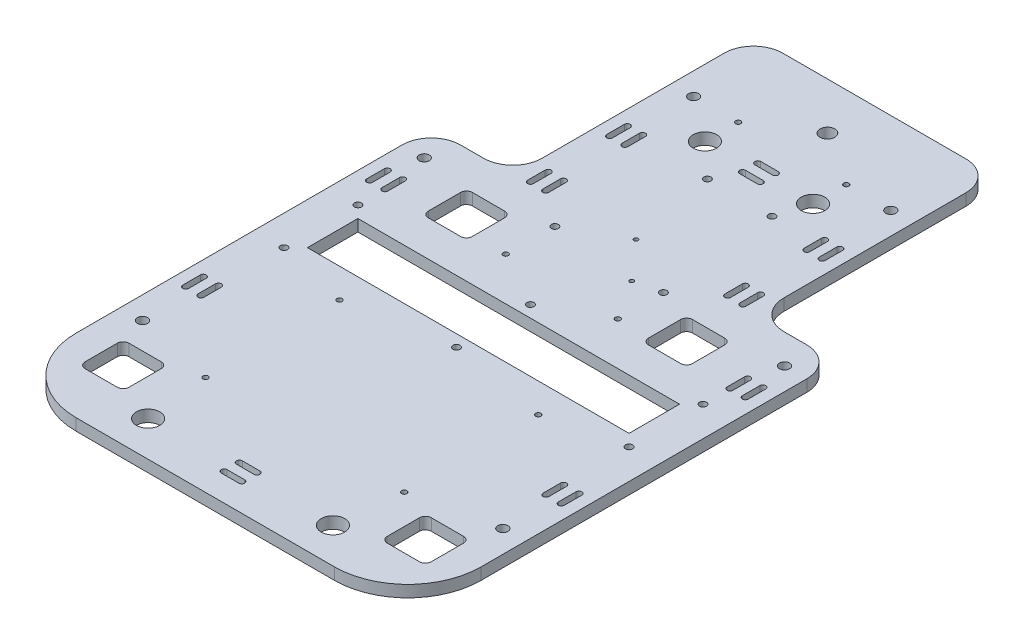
SolidWorks part; units mm, degrees
ref_plane "Front Plane" through (0, 0, 0) normal (0, 0, 1) x (1, 0, 0)
ref_plane "Top Plane" through (0, 0, 0) normal (0, 1, 0) x (1, 0, 0)
ref_plane "Right Plane" through (0, 0, 0) normal (1, 0, 0) x (0, 0, -1)
sketch "Sketch1" plane through (0, 0, 0) normal (0, 1, 0) x (1, 0, 0)
  line L0 (0, 0) -> (0, 289.56)
  line L1 (0, 289.56) -> (-52.324, 289.56)
  line L2 (-52.324, 289.56) -> (-52.324, 185.42)
  line L3 (-52.324, 185.42) -> (-87.63, 185.42)
  line L4 (-87.63, 185.42) -> (-87.63, 0)
  line L5 (-87.63, 0) -> (0, 0)
  dimension "D1" = 289.56
  dimension "D2" = 87.63
  dimension "D3" = 104.14
  dimension "D4" = 52.324
extrude "Plate" add sketch "Sketch1" along normal blind 5.08
fillet "Fillet1" radius 12.7 2 edges at (-52.324, 2.54, -185.42) (-87.63, 2.54, -185.42)
fillet "Fillet2" radius 12.7 1 edges at (-52.324, 2.54, -289.56)
fillet "Fillet3" radius 31.75 1 edges at (-87.63, 2.54, 0)
sketch "Sketch2" plane through (0, 5.08, 0) normal (0, 1, 0) x (1, 0, 0)
  line L0 (0, 0) -> (0, 289.56) construction
  line L1 (-69.596, 135.636) -> (0, 135.636)
  line L2 (-69.596, 135.636) -> (-69.596, 113.792)
  line L3 (-69.596, 113.792) -> (0, 113.792)
  line L4 (0, 135.636) -> (0, 113.792)
  line L5 (-55.88, 0) -> (0, 0) construction
  dimension "D1" = 21.844
  dimension "D2" = 69.596
  dimension "D3" = 113.792
extrude "BatterySlot" cut sketch "Sketch2" against normal through all
sketch "Sketch6" plane through (0, 5.08, 0) normal (0, 1, 0) x (1, 0, 0)
  line L0 (-55.88, 0) -> (0, 0) construction
  line L1 (-57.15, 170.18) -> (-38.1, 170.18)
  line L2 (-57.15, 170.18) -> (-57.15, 151.13)
  line L3 (-57.15, 151.13) -> (-38.1, 151.13)
  line L4 (-38.1, 170.18) -> (-38.1, 151.13)
  line L5 (-74.93, 39.37) -> (-55.88, 39.37)
  line L6 (-74.93, 39.37) -> (-74.93, 20.32)
  line L7 (-74.93, 20.32) -> (-55.88, 20.32)
  line L8 (-55.88, 39.37) -> (-55.88, 20.32)
  line L9 (-87.63, 172.72) -> (-87.63, 31.75) construction
  line L10 (-65.024, 185.42) -> (-74.93, 185.42) construction
  dimension "D1" = 19.05
  dimension "D2" = 20.32
  dimension "D3" = 12.7
  dimension "D4" = 30.48
  dimension "D5" = 15.24
extrude "CableHoles" cut sketch "Sketch6" against normal through all
fillet "CabelHoleFillets" radius 2.54 8 edges at (-57.15, 2.54, -151.13) (-57.15, 2.54, -170.18) (-38.1, 2.54, -170.18) (-38.1, 2.54, -151.13) (-55.88, 2.54, -20.32) (-55.88, 2.54, -39.37) (-74.93, 2.54, -39.37) (-74.93, 2.54, -20.32)
sketch "Sketch7" plane through (0, 5.08, 0) normal (0, 1, 0) x (1, 0, 0)
  line L0 (-55.88, 0) -> (0, 0) construction
  line L2 (0, 0) -> (0, 113.792) construction
  line L5 (0, 289.56) -> (-39.624, 289.56) construction
  line L6 (0, 135.636) -> (0, 289.56) construction
  circle A0 centre (-23.401, 239.6236) radius 5.08
  circle A1 centre (-39.9999, 15.24) radius 5.08
  dimension "D1" = 10.16
  dimension "D2" = 15.24
  dimension "D3" = 224.3836
  dimension "D4" = 39.9999
  dimension "D5" = 23.401
  dimension "D6" = 49.9364
extrude "AnchorHoles" cut sketch "Sketch7" against normal through all
sketch "Sketch8" plane through (0, 5.08, 0) normal (0, 1, 0) x (1, 0, 0)
  line L0 (-45.974, 228.6) -> (-45.974, 220.98) construction
  line L1 (-44.704, 228.6) -> (-44.704, 220.98)
  line L2 (-47.244, 228.6) -> (-47.244, 220.98)
  line L3 (-39.37, 228.6) -> (-39.37, 220.98) construction
  line L4 (-38.1, 228.6) -> (-38.1, 220.98)
  line L5 (-40.64, 228.6) -> (-40.64, 220.98)
  line L6 (-45.974, 194.31) -> (-45.974, 186.69) construction
  line L7 (-44.704, 194.31) -> (-44.704, 186.69)
  line L8 (-47.244, 194.31) -> (-47.244, 186.69)
  line L9 (-39.37, 194.31) -> (-39.37, 186.69) construction
  line L10 (-38.1, 194.31) -> (-38.1, 186.69)
  line L11 (-40.64, 194.31) -> (-40.64, 186.69)
  line L12 (-81.28, 160.02) -> (-81.28, 152.4) construction
  line L13 (-80.01, 160.02) -> (-80.01, 152.4)
  line L14 (-82.55, 160.02) -> (-82.55, 152.4)
  line L15 (-74.676, 160.02) -> (-74.676, 152.4) construction
  line L16 (-73.406, 160.02) -> (-73.406, 152.4)
  line L17 (-75.946, 160.02) -> (-75.946, 152.4)
  line L18 (-81.28, 80.391) -> (-81.28, 72.771) construction
  line L19 (-80.01, 80.391) -> (-80.01, 72.771)
  line L20 (-82.55, 80.391) -> (-82.55, 72.771)
  line L21 (-74.676, 80.391) -> (-74.676, 72.771) construction
  line L22 (-73.406, 80.391) -> (-73.406, 72.771)
  line L23 (-75.946, 80.391) -> (-75.946, 72.771)
  line L24 (-69.596, 113.792) -> (-69.596, 39.37) construction
  line L27 (-58.42, 39.37) -> (-72.39, 39.37) construction
  line L30 (-52.324, 276.86) -> (-52.324, 198.12) construction
  line L31 (-87.63, 172.72) -> (-87.63, 31.75) construction
  line L32 (-3.81, 236.3216) -> (3.81, 236.3216) construction
  line L33 (-3.81, 237.5916) -> (3.81, 237.5916)
  line L34 (-3.81, 235.0516) -> (3.81, 235.0516)
  line L35 (-3.81, 242.9256) -> (3.81, 242.9256) construction
  line L36 (-3.81, 244.1956) -> (3.81, 244.1956)
  line L37 (-3.81, 241.6556) -> (3.81, 241.6556)
  line L38 (-3.81, 11.938) -> (3.81, 11.938) construction
  line L39 (-3.81, 13.208) -> (3.81, 13.208)
  line L40 (-3.81, 10.668) -> (3.81, 10.668)
  line L41 (-3.81, 18.542) -> (3.81, 18.542) construction
  line L42 (-3.81, 19.812) -> (3.81, 19.812)
  line L43 (-3.81, 17.272) -> (3.81, 17.272)
  line L45 (0, 0) -> (0, 113.792) construction
  line L46 (-54.61, 151.13) -> (-40.64, 151.13) construction
  line L47 (-74.93, 36.83) -> (-74.93, 22.86) construction
  line L48 (-55.88, 0) -> (0, 0) construction
  line L49 (-69.977, 185.42) -> (0, 185.42) construction
  line L50 (-65.024, 185.42) -> (-74.93, 185.42) construction
  line L51 (0, 135.636) -> (0, 289.56) construction
  arc A0 (-44.704, 228.6) -> (-47.244, 228.6) centre (-45.974, 228.6) ccw
  arc A1 (-47.244, 220.98) -> (-44.704, 220.98) centre (-45.974, 220.98) ccw
  arc A2 (-38.1, 228.6) -> (-40.64, 228.6) centre (-39.37, 228.6) ccw
  arc A3 (-40.64, 220.98) -> (-38.1, 220.98) centre (-39.37, 220.98) ccw
  arc A4 (-44.704, 194.31) -> (-47.244, 194.31) centre (-45.974, 194.31) ccw
  arc A5 (-47.244, 186.69) -> (-44.704, 186.69) centre (-45.974, 186.69) ccw
  arc A6 (-38.1, 194.31) -> (-40.64, 194.31) centre (-39.37, 194.31) ccw
  arc A7 (-40.64, 186.69) -> (-38.1, 186.69) centre (-39.37, 186.69) ccw
  arc A8 (-80.01, 160.02) -> (-82.55, 160.02) centre (-81.28, 160.02) ccw
  arc A9 (-82.55, 152.4) -> (-80.01, 152.4) centre (-81.28, 152.4) ccw
  arc A10 (-73.406, 160.02) -> (-75.946, 160.02) centre (-74.676, 160.02) ccw
  arc A11 (-75.946, 152.4) -> (-73.406, 152.4) centre (-74.676, 152.4) ccw
  arc A12 (-80.01, 80.391) -> (-82.55, 80.391) centre (-81.28, 80.391) ccw
  arc A13 (-82.55, 72.771) -> (-80.01, 72.771) centre (-81.28, 72.771) ccw
  arc A14 (-73.406, 80.391) -> (-75.946, 80.391) centre (-74.676, 80.391) ccw
  arc A15 (-75.946, 72.771) -> (-73.406, 72.771) centre (-74.676, 72.771) ccw
  arc A20 (-3.81, 237.5916) -> (-3.81, 235.0516) centre (-3.81, 236.3216) ccw
  arc A21 (3.81, 235.0516) -> (3.81, 237.5916) centre (3.81, 236.3216) ccw
  arc A22 (-3.81, 244.1956) -> (-3.81, 241.6556) centre (-3.81, 242.9256) ccw
  arc A23 (3.81, 241.6556) -> (3.81, 244.1956) centre (3.81, 242.9256) ccw
  arc A24 (-3.81, 13.208) -> (-3.81, 10.668) centre (-3.81, 11.938) ccw
  arc A25 (3.81, 10.668) -> (3.81, 13.208) centre (3.81, 11.938) ccw
  arc A26 (-3.81, 19.812) -> (-3.81, 17.272) centre (-3.81, 18.542) ccw
  arc A27 (3.81, 17.272) -> (3.81, 19.812) centre (3.81, 18.542) ccw
  circle A29 centre (-39.9999, 15.24) radius 5.08 construction
  circle A30 centre (-23.401, 239.6236) radius 5.08 construction
  point P2 (-45.974, 224.79)
  point P7 (-39.37, 224.79)
  point P14 (-45.974, 219.71)
  point P15 (-45.974, 229.87)
  point P18 (-45.974, 190.5)
  point P23 (-39.37, 190.5)
  point P34 (-81.28, 156.21)
  point P39 (-74.676, 156.21)
  point P50 (-81.28, 76.581)
  point P55 (-74.676, 76.581)
  point P68 (-69.596, 76.581)
  point P73 (-73.406, 76.581)
  point P77 (-74.676, 161.29)
  point P78 (0, 236.3216)
  point P83 (0, 242.9256)
  point P90 (0, 11.938)
  point P97 (0, 18.542)
  point P107 (-81.28, 71.501)
  point P113 (-45.974, 185.42)
  point P117 (-47.625, 151.13)
  point P118 (-74.676, 151.13)
  point P122 (-45.974, 195.58)
  dimension "D8" = 2.032
  dimension "D1" = 10.16
  dimension "D2" = 2.54
  dimension "D3" = 4.064
  dimension "D4" = 5.08
  dimension "D5" = 5.08
  dimension "D6" = 4.064
  dimension "D7" = 2.032
  dimension "D9" = 4.064
  dimension "D10" = 2.032
  dimension "D11" = 2.032
  dimension "D12" = 4.064
  dimension "D13" = 24.13
  dimension "D15" = 24.13
  dimension "D16" = 71.501
  dimension "D17" = 0
extrude "ZipTieHoles" cut sketch "Sketch8" against normal through all
sketch "Sketch3" plane through (0, 5.08, 0) normal (0, 1, 0) x (1, 0, 0)
  line L0 (-23.401, 234.5436) -> (-23.401, 289.56) construction
  line L1 (0, 0) -> (0, 10.668) construction
  line L2 (-69.596, 113.792) -> (0, 113.792) construction
  line L3 (0, 244.1956) -> (0, 289.56) construction
  line L4 (0, 289.56) -> (-39.624, 289.56) construction
  circle A0 centre (-23.401, 254) radius 1.1303
  circle A7 centre (-43, 101.092) radius 1.1303
  circle A8 centre (-43, 43.092) radius 1.1303
  circle A9 centre (-23.401, 239.6236) radius 5.08 construction
  dimension "D1" = 2.2606
  dimension "D2" = 12.7
  dimension "D3" = 58
  dimension "D4" = 43
  dimension "D5" = 23.401
  dimension "D8" = 35.56
extrude "4-40TapHoles" cut sketch "Sketch3" against normal through all
sketch "Sketch4" plane through (0, 5.08, 0) normal (0, 1, 0) x (1, 0, 0)
  line L0 (-69.596, 113.792) -> (0, 113.792) construction
  line L1 (0, 135.636) -> (-69.596, 135.636) construction
  line L2 (0, 135.636) -> (0, 235.0516) construction
  line L3 (0, 0) -> (0, 10.668) construction
  line L6 (0, 135.636) -> (0, 235.0516) construction
  line L7 (-69.596, 135.636) -> (-69.596, 113.792) construction
  circle A0 centre (-74.676, 140.716) radius 1.524
  circle A1 centre (0, 140.716) radius 1.524
  circle A2 centre (0, 108.712) radius 1.524
  circle A3 centre (-74.676, 108.712) radius 1.524
  dimension "D4" = 3.048
  dimension "D5" = 32.004
  dimension "D1" = 5.08
  dimension "D2" = 5.08
  dimension "D3" = 74.676
  dimension "D6" = 5.08
extrude "4-40ThruHolesBattery" cut sketch "Sketch4" against normal through all
sketch "Sketch5" plane through (0, 5.08, 0) normal (0, 1, 0) x (1, 0, 0)
  line L0 (0, 142.24) -> (0, 235.0516) construction
  line L1 (0, 289.56) -> (-39.624, 289.56) construction
  circle A0 centre (0, 269.24) radius 3.175
  dimension "D1" = 6.35
  dimension "D2" = 20.32
extrude "1/4-20ThruHolesCamera" cut sketch "Sketch5" against normal through all
sketch "Sketch9" plane through (0, 5.08, 0) normal (0, 1, 0) x (1, 0, 0)
  line L2 (-65.024, 185.42) -> (-74.93, 185.42) construction
  line L6 (-55.88, 0) -> (0, 0) construction
  line L7 (-44.704, 220.98) -> (-44.704, 228.6) construction
  line L8 (-80.01, 152.4) -> (-80.01, 160.02) construction
  line L9 (-23.401, 254) -> (-52.324, 254) construction
  line L10 (-52.324, 276.86) -> (-52.324, 198.12) construction
  circle A0 centre (-42.672, 254) radius 2.1844
  circle A1 centre (-77.978, 50.8) radius 2.1844
  circle A2 centre (-77.978, 172.72) radius 2.1844
  dimension "D6" = 4.3688
  dimension "D1" = 2.032
  dimension "D2" = 12.7
  dimension "D3" = 2.032
  dimension "D5" = 50.8
extrude "8-32ThruHolesStandoff" cut sketch "Sketch9" against normal through all
mirror "Mirror1" about plane through (0, 5.08, 0) normal (0, 1, 0) of "1/4-20ThruHolesCamera", "4-40ThruHolesBattery", "4-40TapHoles", "AnchorHoles", "CabelHoleFillets", "CableHoles", "BatterySlot", "Fillet3", "Fillet2", "Fillet1", "Plate", "8-32ThruHolesStandoff", "ZipTieHoles"
sketch "Sketch11" plane through (0, 5.08, 0) normal (0, 1, 0) x (1, 0, 0)
  line L0 (-52.324, 276.86) -> (-52.324, 198.12) construction
  line L2 (39.624, 289.56) -> (-39.624, 289.56) construction
  circle A0 centre (-1.524, 187.96) radius 0.889
  circle A1 centre (13.0759, 171.45) radius 0.889
  dimension "D1" = 1.778
  dimension "D5" = 101.6
  dimension "D2" = 16.51
  dimension "D3" = 14.5999
  dimension "D4" = 50.8
extrude "2-56TapHolesPWM" cut sketch "Sketch11" against normal through all
sketch "Sketch12" plane through (0, 5.08, 0) normal (0, 1, 0) x (1, 0, 0)
  line L0 (0, 269.24) -> (0, 140.716) construction
  line L1 (-24.257, 154.26) -> (24.257, 154.26) construction
  line L2 (39.624, 289.56) -> (-39.624, 289.56) construction
  circle A0 centre (-8.763, 226.06) radius 1.524
  circle A1 centre (19.177, 226.06) radius 1.524
  circle A2 centre (-24.003, 175.26) radius 1.524
  circle A3 centre (24.257, 173.99) radius 1.524
  circle A4 centre (-24.257, 154.26) radius 1.1303
  circle A5 centre (24.257, 154.26) radius 1.1303
  point P16 (0, 154.26)
  dimension "D1" = 3.048
  dimension "D2" = 50.8
  dimension "D3" = 48.514
  dimension "D5" = 27.94
  dimension "D6" = 52.07
  dimension "D7" = 21
  dimension "D8" = 5.08
  dimension "D9" = 63.5
  dimension "D10" = 15.24
  dimension "D11" = 2.2606
  dimension "D4" = 0.254
extrude "4-40MixedHolesArduino" cut sketch "Sketch12" against normal through all
